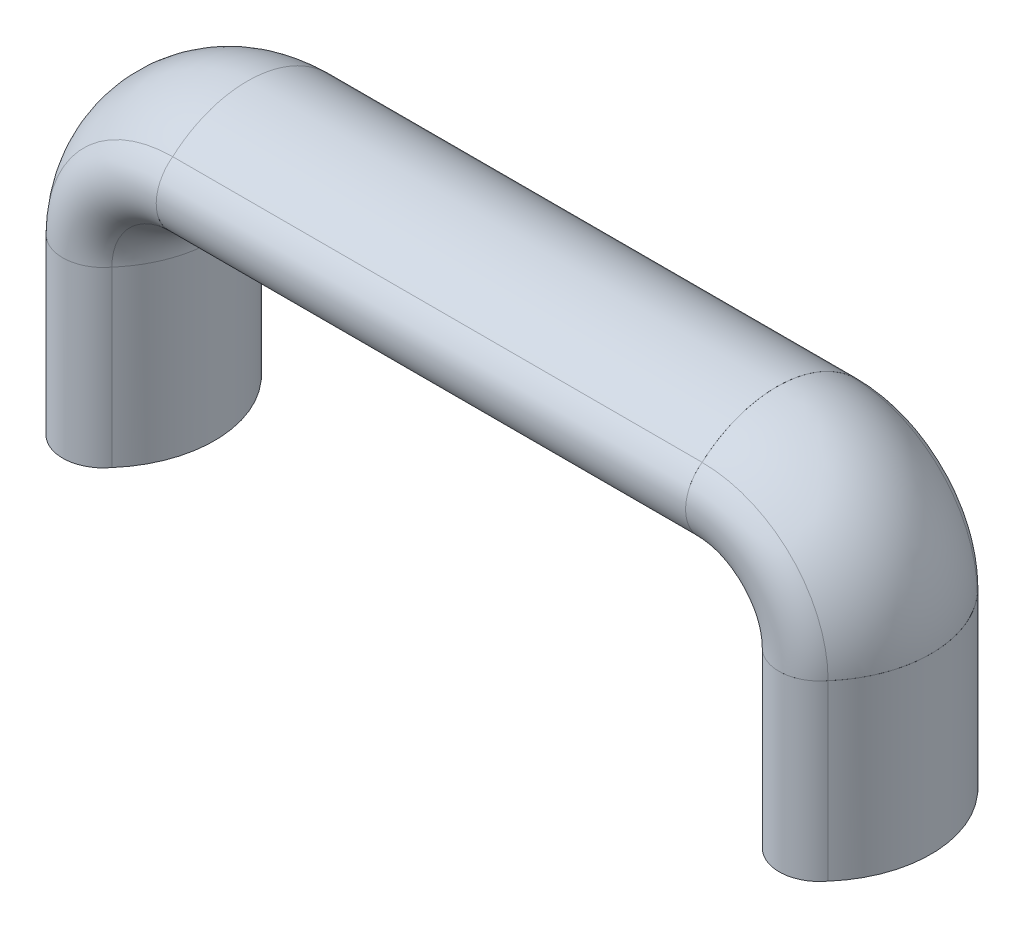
SolidWorks part; units mm, degrees
ref_plane "Plan de face" through (0, 0, 0) normal (0, 0, 1) x (1, 0, 0)
ref_plane "Plan de dessus" through (0, 0, 0) normal (0, 1, 0) x (1, 0, 0)
ref_plane "Plan de droite" through (0, 0, 0) normal (1, 0, 0) x (0, 0, -1)
imported_body " Importée1"
hole_wizard "Trou taraudé M8x1.251" positions "Esquisse2" profile "Esquisse1" tap size "M8x1.25" standard "ISO"
sketch "Esquisse2" plane through (0, 0, 0) normal (0, -1, 0) x (1, 0, 0)
  point P0 (-58.5, 0)
sketch "Esquisse1" plane through (-58.5, 0, 0) normal (1, 0, 0) x (0, 0, -1)
  line L0 (0, 0) -> (0, 21.7929)
  line L1 (0, 21.7929) -> (3.4, 19.75)
  line L2 (3.4, 19.75) -> (3.4, 0)
  line L5 (3.4, 0) -> (0, 0)
  line L10 (0, 21.7929) -> (-3.4, 19.75) construction
  line L11 (0, -6.35) -> (0, 107.95) construction
  dimension "Diamètre du trou pour taraudage" = 6.8
  dimension "Profondeur du trou pour taraudage" = 19.75
  dimension "Angle de pointe" = 118
hole_wizard "Trou taraudé M8x1.252" positions "Esquisse4" profile "Esquisse3" tap size "M8x1.25" standard "ISO"
sketch "Esquisse4" plane through (0, 0, 0) normal (0, -1, 0) x (1, 0, 0)
  point P0 (58.5, 0)
sketch "Esquisse3" plane through (58.5, 0, 0) normal (1, 0, 0) x (0, 0, -1)
  line L0 (0, 0) -> (0, 21.7929)
  line L1 (0, 21.7929) -> (3.4, 19.75)
  line L2 (3.4, 19.75) -> (3.4, 0)
  line L5 (3.4, 0) -> (0, 0)
  line L10 (0, 21.7929) -> (-3.4, 19.75) construction
  line L11 (0, -6.35) -> (0, 107.95) construction
  dimension "Diamètre du trou pour taraudage" = 6.8
  dimension "Profondeur du trou pour taraudage" = 19.75
  dimension "Angle de pointe" = 118
